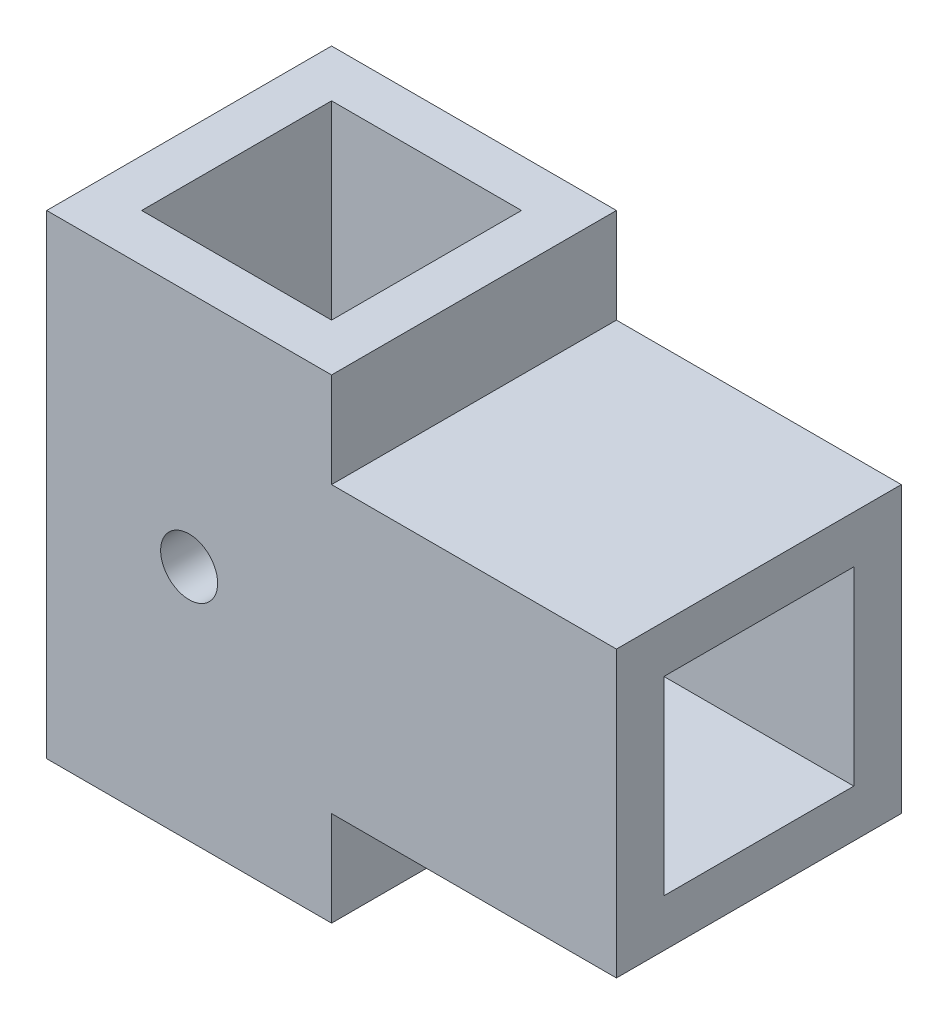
SolidWorks part; units mm, degrees
ref_plane "Alzado" through (0, 0, 0) normal (0, 0, 1) x (1, 0, 0)
ref_plane "Planta" through (0, 0, 0) normal (0, 1, 0) x (1, 0, 0)
ref_plane "Vista lateral" through (0, 0, 0) normal (1, 0, 0) x (0, 0, -1)
sketch "Sketch1" plane through (0, 0, 0) normal (0, 0, 1) x (1, 0, 0)
  line L0 (15, 15) -> (15, 25)
  line L1 (-15, -25) -> (15, -25)
  line L2 (-15, -25) -> (-15, 25)
  line L3 (-15, 25) -> (15, 25)
  line L4 (15, -25) -> (15, -15)
  line L5 (-15, -25) -> (15, 25) construction
  line L6 (-15, 25) -> (15, -25) construction
  line L7 (15, 15) -> (45, 15)
  line L9 (15, -15) -> (45, -15)
  line L10 (45, 15) -> (45, -15)
  circle A0 centre (0, 0) radius 3
  point P0 (0, 0)
  point P10 (45, 0)
  dimension "D5" = 6
  dimension "D1" = 30
  dimension "D2" = 50
  dimension "D3" = 45
  dimension "D4" = 30
extrude "Boss-Extrude1" add sketch "Sketch1" along normal mid plane 30
sketch "Sketch2" plane through (0, 25, 0) normal (0, 1, 0) x (1, 0, 0)
  line L8 (10, 10) -> (-10, 10)
  line L9 (-10, 10) -> (-10, -10)
  line L10 (-10, -10) -> (10, -10)
  line L11 (10, -10) -> (10, 10)
  line L12 (10, 10) -> (-10, 10)
  line L13 (-10, 10) -> (-10, -10)
  line L14 (-10, -10) -> (10, -10)
  line L15 (10, -10) -> (10, 10)
  dimension "D1" = 5
extrude "Cut-Extrude1" cut sketch "Sketch2" against normal blind 59
sketch "Sketch3" plane through (45, 0, 0) normal (1, 0, 0) x (0, 0, -1)
  line L8 (10, -10) -> (10, 10)
  line L9 (10, 10) -> (-10, 10)
  line L10 (-10, 10) -> (-10, -10)
  line L11 (-10, -10) -> (10, -10)
  line L12 (10, -10) -> (10, 10)
  line L13 (10, 10) -> (-10, 10)
  line L14 (-10, 10) -> (-10, -10)
  line L15 (-10, -10) -> (10, -10)
  dimension "D1" = 5
extrude "Cut-Extrude2" cut sketch "Sketch3" against normal blind 25
